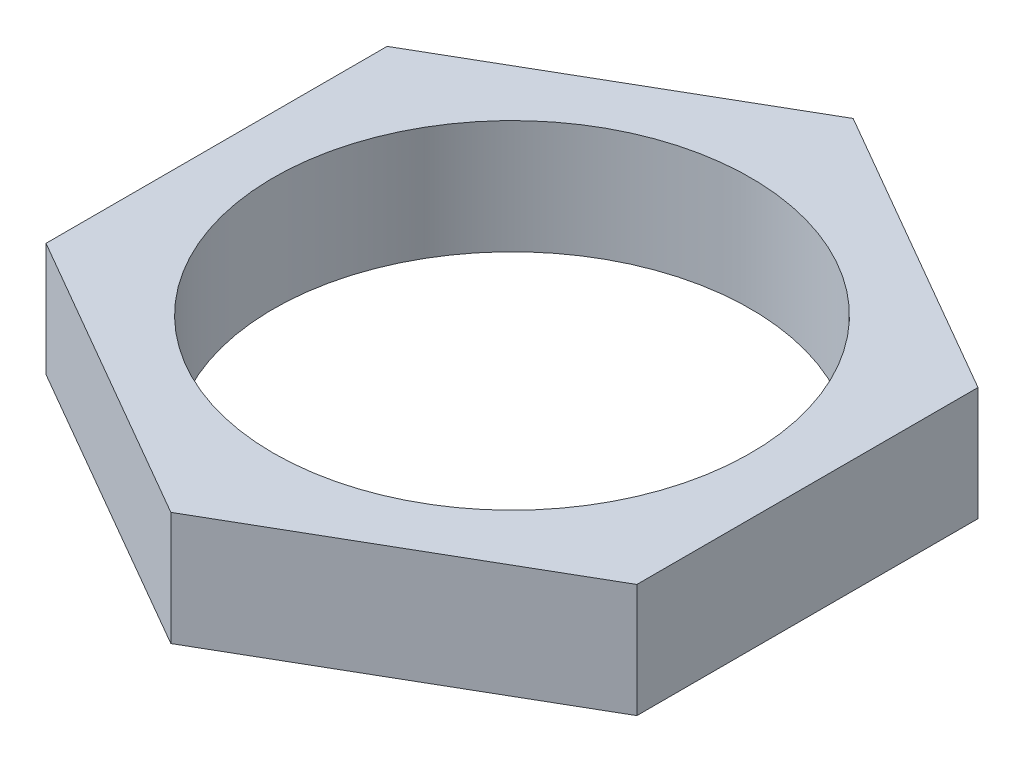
SolidWorks part; units mm, degrees
ref_plane "Front Plane" through (0, 0, 0) normal (0, 0, 1) x (1, 0, 0)
ref_plane "Top Plane" through (0, 0, 0) normal (0, 1, 0) x (1, 0, 0)
ref_plane "Right Plane" through (0, 0, 0) normal (1, 0, 0) x (0, 0, -1)
sketch "Sketch1" plane through (0, 0, 0) normal (0, 1, 0) x (1, 0, 0)
  line L1 (0, 15.0111) -> (-13, 7.5056)
  line L2 (-13, 7.5056) -> (-13, -7.5056)
  line L3 (-13, -7.5056) -> (0, -15.0111)
  line L4 (0, -15.0111) -> (13, -7.5056)
  line L5 (13, -7.5056) -> (13, 7.5056)
  line L6 (13, 7.5056) -> (0, 15.0111)
  circle A0 centre (0, 0) radius 10.5
  circle A1 centre (0, 0) radius 13 construction
  dimension "D1" = 21
  dimension "D2" = 26
extrude "Boss-Extrude1" add sketch "Sketch1" along normal blind 5
